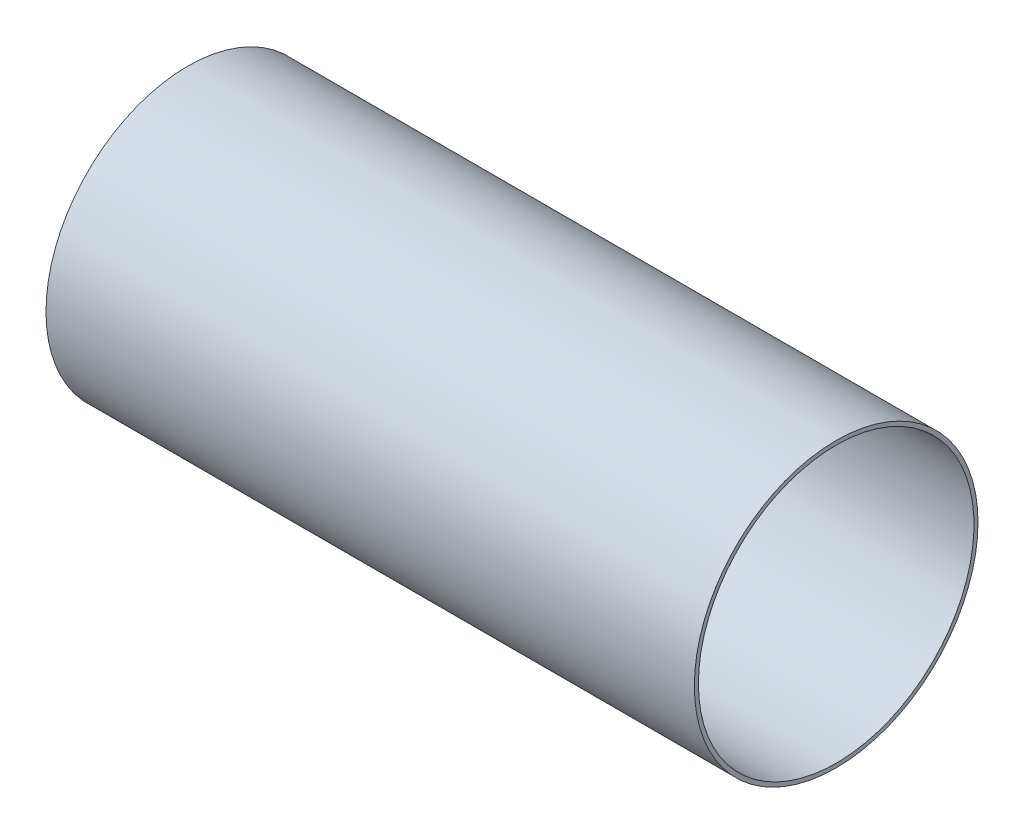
SolidWorks part; units mm, degrees
ref_plane "Face" through (0, 0, 0) normal (0, 0, 1) x (1, 0, 0)
ref_plane "Dessus" through (0, 0, 0) normal (0, 1, 0) x (1, 0, 0)
ref_plane "Droite" through (0, 0, 0) normal (1, 0, 0) x (0, 0, -1)
sketch "Esquisse1" plane through (0, 0, 0) normal (0, 0, 1) x (1, 0, 0)
  line L0 (0, 0) -> (16, 0) construction
  line L1 (0, 3.5) -> (16, 3.5)
  line L2 (0, 3.5) -> (0, 0.8)
  line L3 (0, 0.8) -> (0.8, 0.8)
  dimension "D1" = 3.5
  dimension "D3" = 0.8
  dimension "D4" = 0.8
  dimension "D5" = 16
revolve "Révol.-Mince1" add sketch "Esquisse1" angle 360 about L0
